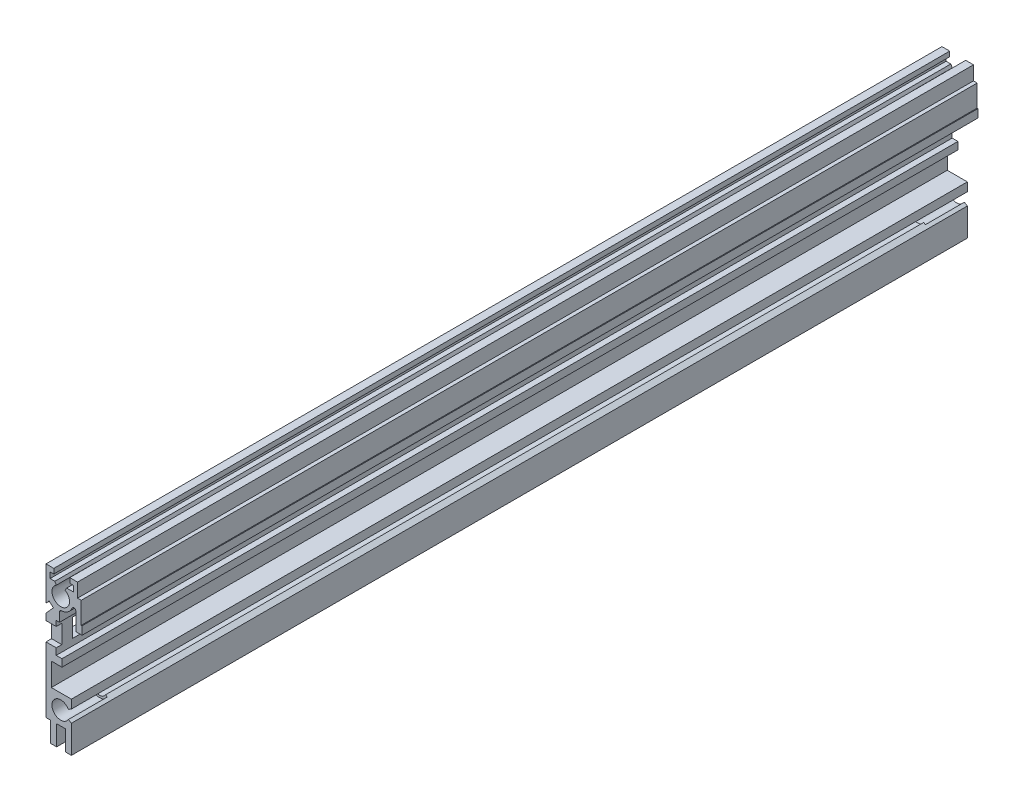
SolidWorks part; units mm, degrees
ref_plane "前视基准面" through (0, 0, 0) normal (0, 0, 1) x (1, 0, 0)
ref_plane "上视基准面" through (0, 0, 0) normal (0, 1, 0) x (1, 0, 0)
ref_plane "右视基准面" through (0, 0, 0) normal (1, 0, 0) x (0, 0, -1)
sketch "草图1" plane through (0, 0, 0) normal (0, 0, 1) x (1, 0, 0)
  line L43 (-2.5, -8.3) -> (-1, -8.3)
  line L44 (1.1, -8.3) -> (2.6, -8.3)
  line L45 (-3.6, -3.4) -> (-3.6, 18.7)
  line L46 (-3.6, 20.7928) -> (-3.6, 29.1)
  line L47 (0.3, 9.2) -> (0.3, 11)
  line L48 (-1.1, 11) -> (-1.1, 18.4)
  line L49 (-2.3, 3.6) -> (-2.3, 9.2)
  line L50 (1.1, -8.3) -> (1.1, -3.4)
  line L51 (-1, -8.3) -> (-1, -3.4)
  line L52 (-2.5, -8.3) -> (-2.5, -3.4)
  line L53 (2.2, 29.1) -> (4.1, 29.1)
  line L54 (1.4434, 26.5) -> (3.1, 26.5)
  line L55 (2.2, 27.9) -> (3.1, 27.9)
  line L56 (4.1, 25.7) -> (5, 25.7)
  line L57 (5, 20.4) -> (5.2, 20.4)
  line L58 (3.7, 18.4) -> (5.2, 18.4)
  line L59 (-1.1, 11) -> (0.3, 11)
  line L60 (-2.3, 9.2) -> (0.3, 9.2)
  line L61 (-2.3, 3.6) -> (2.6, 3.6)
  line L62 (-1, -3.4) -> (1.1, -3.4)
  line L63 (-2.5, -3.4) -> (-3.6, -3.4)
  line L64 (2.6, -8.3) -> (2.6, -1.5011)
  line L65 (5.2, 20.4) -> (5.2, 18.4)
  line L66 (5, 25.7) -> (5, 20.4)
  line L67 (-0.3, 20.5558) -> (-0.3, 18.4)
  line L68 (3.7, 22.7106) -> (3.7, 18.4)
  line L69 (1.4289, 0.825) -> (2.6, 1.5011)
  line L70 (1.4289, -0.825) -> (2.6, -1.5011)
  line L71 (2.6, 1.5011) -> (2.6, 3.6)
  line L72 (-1.1, 18.4) -> (-0.3, 18.4)
  line L73 (4.1, 25.7) -> (4.1, 29.1)
  line L74 (3.1, 26.5) -> (3.1, 27.9)
  line L75 (2.2, 27.9) -> (2.2, 29.1)
  line L76 (-0.825, 25.4289) -> (-1.4434, 26.5)
  line L77 (0.825, 25.4289) -> (1.4434, 26.5)
  line L78 (-1.4434, 26.5) -> (-2.6, 26.5)
  line L79 (-1.7, 27.9) -> (-2.6, 27.9)
  line L80 (-2.6, 26.5) -> (-2.6, 27.9)
  line L81 (-1.7, 27.9) -> (-1.7, 29.1)
  line L82 (-1.7, 29.1) -> (-3.6, 29.1)
  line L83 (-1.8, 20.7) -> (-3.6, 18.7)
  line L84 (-2.8406, 21.6366) -> (-3.6, 20.7928)
  line L85 (-1.8, 20.7) -> (-2.8406, 21.6366)
  arc A5 (-0.825, 25.4289) -> (0.825, 25.4289) centre (0, 24) ccw
  arc A6 (0.171, 21.055) -> (2.7362, 22.8975) centre (0, 24) ccw
  arc A7 (0.171, 21.055) -> (-0.3, 20.5558) centre (0.2, 20.5558) ccw
  arc A8 (3.7, 22.7106) -> (2.7362, 22.8975) centre (3.2, 22.7106) ccw
  arc A9 (1.4289, 0.825) -> (1.4289, -0.825) centre (0, 0) ccw
extrude "凸台-拉伸1" add sketch "草图1" against normal blind 218.74
sketch "草图2" plane through (-1.1, 0, 0) normal (1, 0, 0) x (0, 0, -1)
  line L0 (218.74, 29.1) -> (0, 29.1) construction
  line L1 (4.02, 17.1) -> (11.52, 17.1)
  line L2 (4.02, 17.1) -> (4.02, 12.6)
  line L3 (4.02, 12.6) -> (11.52, 12.6)
  line L4 (11.52, 17.1) -> (11.52, 12.6)
  line L5 (4.02, 17.1) -> (11.52, 12.6) construction
  line L6 (4.02, 12.6) -> (11.52, 17.1) construction
  line L7 (0, 11) -> (0, 18.4) construction
  point P0 (7.77, 14.85)
  dimension "D1" = 7.5
  dimension "D2" = 4.5
  dimension "D3" = 12
  dimension "D4" = 4.02
extrude "切除-拉伸1" cut sketch "草图2" against normal up to next
pattern_linear "阵列(线性)1" count 21 spacing 10.16 along (0, 0, -1) of "切除-拉伸1"
sketch "草图3" plane through (0, 0, 0) normal (0, 0, 1) x (1, 0, 0)
  circle A0 centre (0, 0) radius 2.15
  circle A1 centre (0, 24) radius 2.15
extrude "切除-拉伸2" cut sketch "草图3" against normal blind 9.5
sketch "草图4" plane through (0, 0, -218.74) normal (0, 0, -1) x (-1, 0, 0)
  circle A0 centre (0, 0) radius 2.15
  circle A1 centre (0, 24) radius 2.15
  dimension "D1" = 4.3
  dimension "D2" = 4.3
extrude "切除-拉伸3" cut sketch "草图4" against normal blind 9.5
sketch "草图5" plane through (-3.6, 0, 0) normal (-1, 0, 0) x (0, 0, 1)
  line L0 (0, 18.7) -> (0, -3.4) construction
  line L1 (-1.36, 17.1) -> (0, 17.1)
  line L2 (-1.36, 17.1) -> (-1.36, 12.6)
  line L3 (-1.36, 12.6) -> (0, 12.6)
  line L4 (0, 17.1) -> (0, 12.6)
  line L5 (-11.52, 17.1) -> (-4.02, 17.1) construction
  line L6 (-4.02, 12.6) -> (-11.52, 12.6) construction
  line L7 (-4.02, 17.1) -> (-4.02, 12.6) construction
  line L8 (-109.37, 29.1) -> (-109.37, -8.3) construction
  line L9 (-218.74, 29.1) -> (0, 29.1) construction
  line L10 (-218.74, -8.3) -> (0, -8.3) construction
  line L11 (-218.74, 17.1) -> (-218.74, 12.6)
  line L12 (-217.38, 12.6) -> (-218.74, 12.6)
  line L13 (-217.38, 17.1) -> (-217.38, 12.6)
  line L14 (-217.38, 17.1) -> (-218.74, 17.1)
  dimension "D1" = 2.66
extrude "切除-拉伸4" cut sketch "草图5" against normal blind 10
